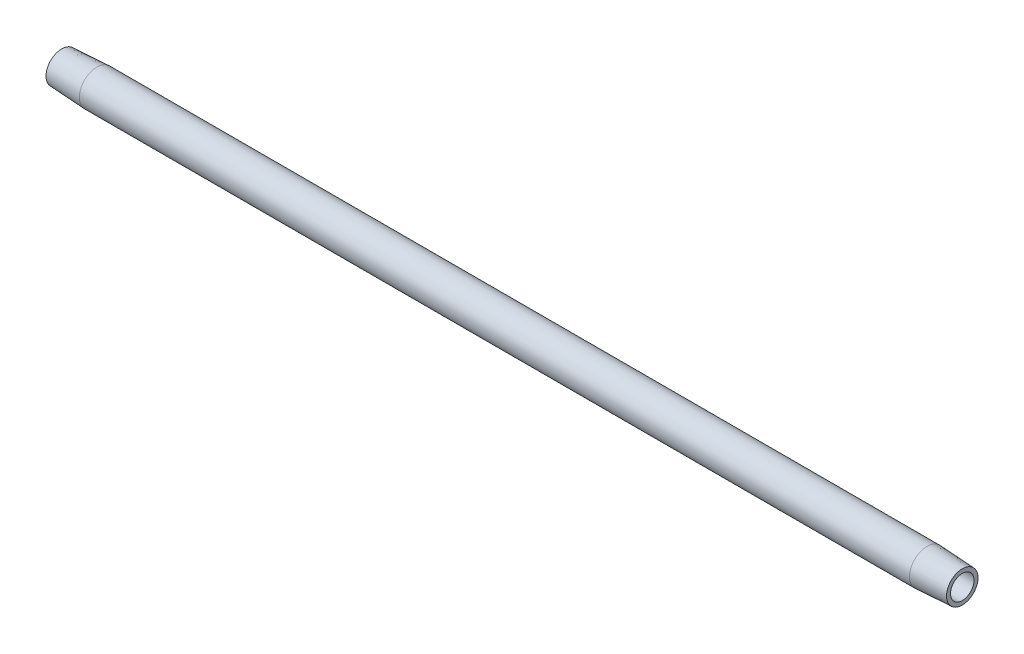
SolidWorks part; units mm, degrees
ref_plane "Front Plane" through (0, 0, 0) normal (0, 0, 1) x (1, 0, 0)
ref_plane "Top Plane" through (0, 0, 0) normal (0, 1, 0) x (1, 0, 0)
ref_plane "Right Plane" through (0, 0, 0) normal (1, 0, 0) x (0, 0, -1)
sketch "Sketch2" plane through (0, 0, 0) normal (0, 0, 1) x (1, 0, 0)
  line L0 (0.4761, 0) -> (50000.4761, 0) construction
  line L1 (0, -11.3625) -> (0, 49988.6375) construction
  line L7 (7.9375, 3.9687) -> (0, 3.5528)
  line L8 (195.2625, 3.9688) -> (7.9375, 3.9687)
  line L9 (203.2, 3.5528) -> (195.2625, 3.9688)
  line L10 (203.2, 2.6543) -> (203.2, 3.5528)
  line L11 (203.2, 2.6543) -> (0, 2.6543)
  line L12 (0, 3.5528) -> (0, 2.6543)
  dimension "D1" = 5.3086
  dimension "D2" = 7.9375
  dimension "D3" = 3
  dimension "D4" = 3
  dimension "D5" = 7.9375
  dimension "D6" = 7.9375
  dimension "D7" = 203.2
revolve "Revolve1" add sketch "Sketch2" angle 360 about L0
